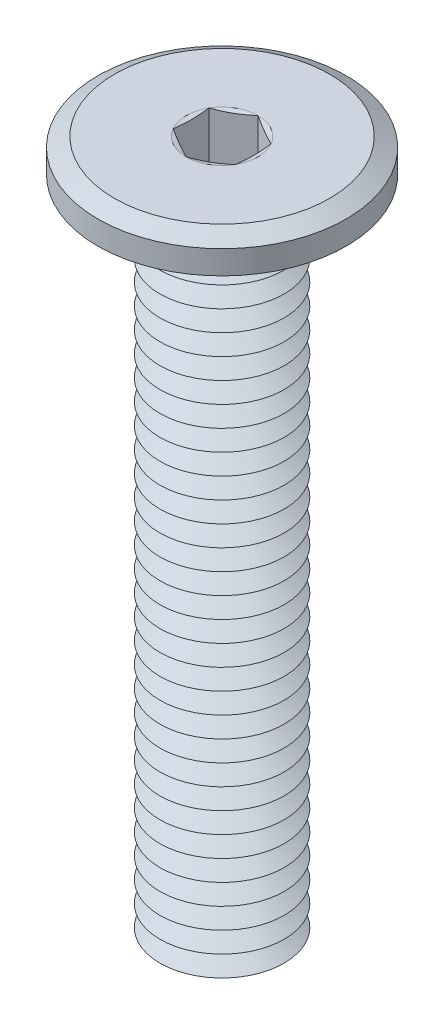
SolidWorks part; units mm, degrees
ref_plane "Front Plane" through (0, 0, 0) normal (0, 0, 1) x (1, 0, 0)
ref_plane "Top Plane" through (0, 0, 0) normal (0, 1, 0) x (1, 0, 0)
ref_plane "Right Plane" through (0, 0, 0) normal (1, 0, 0) x (0, 0, -1)
sketch "Sketch1" plane through (0, 0, 0) normal (0, 1, 0) x (1, 0, 0)
  circle A0 centre (0, 0) radius 3
  dimension "D1" = 6
extrude "Boss-Extrude1" add sketch "Sketch1" against normal blind 0.8
sketch "Sketch2" plane through (0, -0.8, 0) normal (0, -1, 0) x (1, 0, 0)
  circle A0 centre (0, 0) radius 1.5
  dimension "D1" = 3
extrude "Boss-Extrude2" add sketch "Sketch2" along normal blind 16
sketch "Sketch3" plane through (0, 0, 0) normal (1, 0, 0) x (0, 0, -1)
  line L0 (0, 0.9906) -> (0, -8.2999) construction
sketch "Sketch5" plane through (0, 0, 0) normal (1, 0, 0) x (0, 0, -1)
  line L0 (-1.5, -17.05) -> (-1.067, -16.8)
  line L1 (-1.5, -0.8) -> (-1.5, -16.8) construction
  line L2 (-1.067, -16.8) -> (-1.5, -16.55)
  line L3 (-1.5, -0.8) -> (-1.5, -16.8) construction
  line L4 (-1.5, -16.55) -> (-1.5, -17.05)
  line L6 (-1.5, -0.8) -> (-1.5, -16.8) construction
  line L7 (-1.5, -0.8) -> (-1.5, -16.8) construction
  line L14 (-1.5, -16.8) -> (1.5, -16.8) construction
  dimension "D1" = 0.5
revolve "Cut-Revolve1" cut sketch "Sketch5" angle 360 about L0
pattern_linear "LPattern1" count 31 spacing 0.5 along (0, 1, 0) of "Cut-Revolve1"
fillet "Fillet1" radius 0.1 1 edges at (0, -0.8, -1.5)
chamfer "Chamfer2" distance 0.4 angle 30 1 edges at (0, 0, 3)
sketch "Sketch6" plane through (0, 0, 0) normal (0, 1, 0) x (1, 0, 0)
  line L1 (0, 0.866) -> (-0.75, 0.433)
  line L2 (-0.75, 0.433) -> (-0.75, -0.433)
  line L3 (-0.75, -0.433) -> (0, -0.866)
  line L4 (0, -0.866) -> (0.75, -0.433)
  line L5 (0.75, -0.433) -> (0.75, 0.433)
  line L6 (0.75, 0.433) -> (0, 0.866)
  circle A0 centre (0, 0) radius 0.75 construction
  dimension "D1" = 1.5
extrude "Cut-Extrude1" cut sketch "Sketch6" against normal blind 1.4
sketch "Sketch7" plane through (0, -1.4, 0) normal (0, 1, 0) x (1, 0, 0)
  line L0 (-0.75, 0.433) -> (-0.75, -0.433) construction
  circle A0 centre (0, 0) radius 0.75
extrude "Cut-Extrude2" cut sketch "Sketch7" against normal through all draft 60
sketch "Sketch8" plane through (0, 0, 0) normal (0, 1, 0) x (1, 0, 0)
  circle A0 centre (0, 0) radius 0.866
extrude "Cut-Extrude3" cut sketch "Sketch8" against normal through all draft 75
